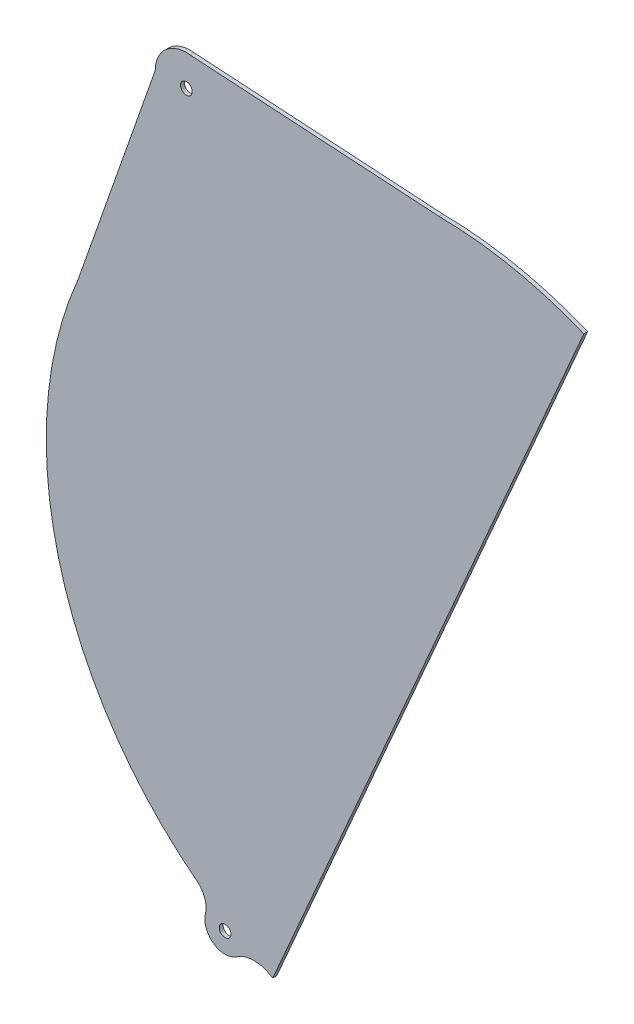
SolidWorks part; units mm, degrees
ref_plane "Front Plane" through (0, 0, 0) normal (0, 0, 1) x (1, 0, 0)
ref_plane "Top Plane" through (0, 0, 0) normal (0, 1, 0) x (1, 0, 0)
ref_plane "Right Plane" through (0, 0, 0) normal (1, 0, 0) x (0, 0, -1)
sketch "Sketch1" plane through (0, 0, 0) normal (0, 0, 1) x (1, 0, 0)
  line L0 (-126.8897, -291.0417) -> (0, 0)
  line L1 (-200.0794, 330.0076) -> (2.9907, 317.4859)
  line L2 (0, 0) -> (126.8897, 291.0417)
  line L3 (-228.6, 304.8) -> (-291.2704, 126.3639)
  line L4 (0, 0) -> (0, -336.0761) construction
  line L5 (0, 0) -> (-211.7385, -338.8524) construction
  circle A1 centre (-171.6144, -274.6404) radius 4.7625
  arc A2 (-187.675, -270.8148) -> (-162.2409, -288.2315) centre (-171.6144, -274.6404) ccw
  arc A3 (-134.8673, -287.4318) -> (-162.2409, -288.2315) centre (-147.9365, -308.972) ccw
  arc A4 (-187.675, -270.8148) -> (-194.0714, -251.2818) centre (-206.7923, -266.2612) ccw
  arc A5 (-134.8673, -287.4318) -> (-126.8897, -291.0417) centre (0, 0) ccw
  circle A6 centre (-203.2, 304.8) radius 4.7625
  arc A7 (-200.0794, 330.0076) -> (-228.6, 304.8) centre (-203.2, 304.8) ccw
  arc A11 (-291.2704, 126.3639) -> (-194.0714, -251.2818) centre (0, 0) ccw
  arc A12 (126.8897, 291.0417) -> (2.9907, 317.4859) centre (0, 0) ccw
  point P6 (-126.8897, -291.0417)
  point P11 (-203.2, 304.8)
  dimension "D1" = 32
  dimension "D2" = 317.5
  dimension "D3" = 323.85
  dimension "D5" = 203.2
  dimension "D7" = 25.4
  dimension "D4" = 16.51
  dimension "D8" = 9.525
  dimension "D9" = 9.525
  dimension "D6" = 304.8
extrude "Boss-Extrude1" add sketch "Sketch1" along normal blind 3.175
sketch "Sketch6" plane through (0, 0, 0) normal (0.9167, -0.3997, 0) x (0, 0, -1)
  line L1 (-3.175, 317.5) -> (0, 317.5)
  line L2 (-3.175, 317.5) -> (-3.175, -317.5)
  line L3 (-3.175, -317.5) -> (0, -317.5)
  line L4 (0, 317.5) -> (0, -317.5)
extrude "Cut-Extrude1" cut sketch "Sketch6" against normal blind 6.35
sketch "Sketch7" plane through (0, 0, 0) normal (0, 0, -1) x (-1, 0, 0)
  line L1 (34.925, 15.2268) -> (0, 0)
  circle A1 centre (34.925, 15.2268) radius 3.175
  dimension "D1" = 6.35
sketch "Sketch11" plane through (0, 0, 0) normal (0, 0, -1) x (-1, 0, 0)
  line L6 (266.4972, 147.9266) -> (233.6269, 241.3193)
  line L7 (233.6269, 241.3193) -> (60.2684, 16.9222)
  line L8 (24.1769, -7.7871) -> (139.0385, -271.2404)
  arc A4 (139.0385, -271.2404) -> (266.4972, 147.9266) centre (0, 0) ccw
  arc A5 (24.1769, -7.7871) -> (60.2684, 16.9222) centre (34.925, 15.2268) ccw
